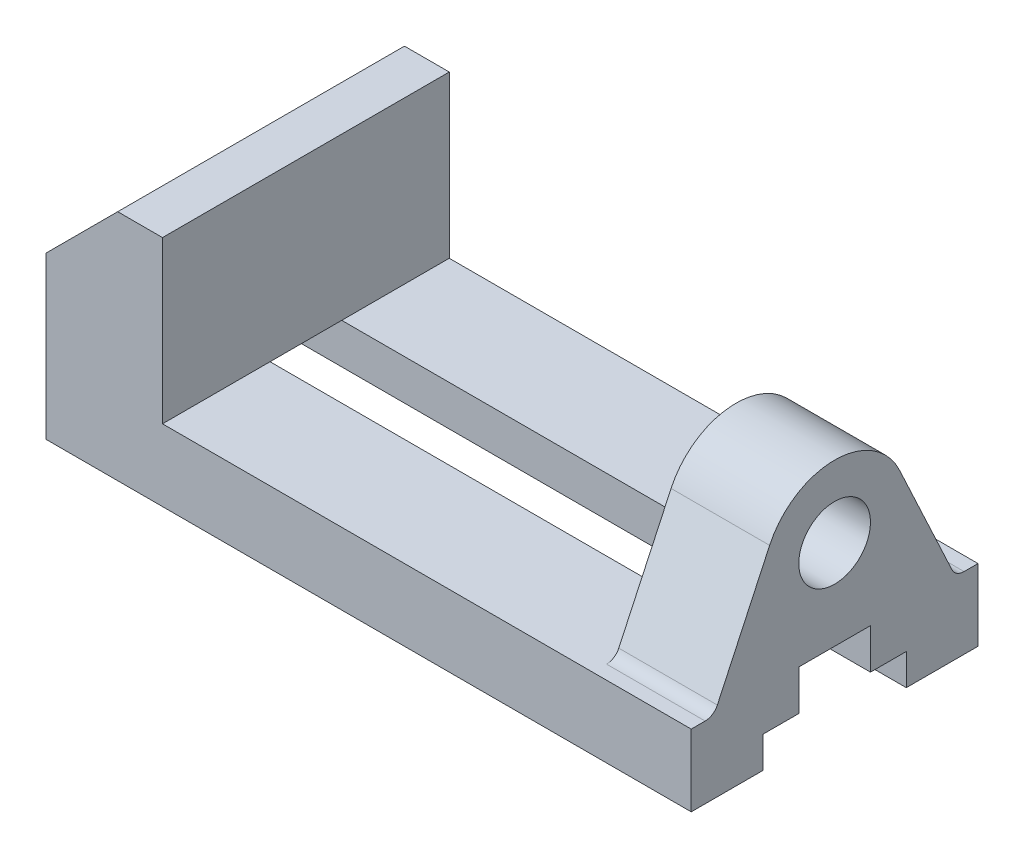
SolidWorks part; units mm, degrees
ref_plane "Front Plane" through (0, 0, 0) normal (0, 0, 1) x (1, 0, 0)
ref_plane "Top Plane" through (0, 0, 0) normal (0, 1, 0) x (1, 0, 0)
ref_plane "Right Plane" through (0, 0, 0) normal (1, 0, 0) x (0, 0, -1)
sketch "Sketch1" plane through (0, 0, 0) normal (0, 0, 1) x (1, 0, 0)
  line L0 (144, 0) -> (0, 0)
  line L1 (0, 0) -> (0, 36)
  line L2 (0, 36) -> (16, 52)
  line L3 (16, 52) -> (26, 52)
  line L4 (26, 52) -> (26, 16)
  line L5 (26, 16) -> (144, 16)
  line L6 (144, 16) -> (144, 0)
  dimension "D1" = 144
  dimension "D2" = 16
  dimension "D3" = 36
  dimension "D4" = 16
  dimension "D5" = 10
  dimension "D6" = 16
extrude "Base" add sketch "Sketch1" along normal mid plane 64
sketch "Sketch2" plane through (144, 0, 0) normal (1, 0, 0) x (0, 0, -1)
  line L0 (-14.5009, 42.7619) -> (-26.9802, 16)
  line L1 (-32, 16) -> (32, 16) construction
  line L2 (26.9802, 16) -> (14.5009, 42.7619)
  line L3 (-32, 16) -> (32, 16) construction
  line L4 (-26.9802, 16) -> (26.9802, 16)
  line L5 (-32, 52) -> (32, 52) construction
  line L6 (0, 36) -> (0, 16) construction
  arc A0 (-14.5009, 42.7619) -> (14.5009, 42.7619) centre (0, 36) cw
  dimension "D1" = 16
  dimension "D2" = 50
extrude "Left end" add sketch "Sketch2" against normal blind 22
sketch "Sketch3" plane through (144, 0, 0) normal (1, 0, 0) x (0, 0, -1)
  line L0 (-16, 0) -> (-16, 7)
  line L1 (-32, 0) -> (32, 0) construction
  line L2 (-16, 7) -> (-8, 7)
  line L3 (-8, 7) -> (-8, 16)
  line L4 (-32, 16) -> (32, 16) construction
  line L5 (-8, 16) -> (8, 16)
  line L6 (8, 16) -> (8, 7)
  line L7 (8, 7) -> (16, 7)
  line L8 (16, 7) -> (16, 0)
  line L9 (16, 0) -> (-16, 0)
  point P4 (0, 0)
  point P13 (0, 16)
  dimension "D1" = 32
  dimension "D2" = 16
  dimension "D3" = 7
  dimension "D4" = 16
extrude "Cut Extrude" cut sketch "Sketch3" against normal through all
other "Dia 16 Hole"
sketch "Sketch4" plane through (144, 0, 0) normal (1, 0, 0) x (0, 0, -1)
  circle A0 centre (0, 36) radius 8
  arc A1 (14.5009, 42.7619) -> (-14.5009, 42.7619) centre (0, 36) ccw construction
  dimension "D1" = 16
hole_wizard "Ø6.0 (6) Diameter Hole1" positions "3DSketch1" profile "Sketch5" hole size "Ø6.0" standard "Ansi Metric"
sketch3d "3DSketch1"
  line L0 (144, 0, 32) -> (144, 0, 16) construction
  line L1 (0, 0, 32) -> (144, 0, 32) construction
  point P0 (106, 0, 22)
  dimension "D1" = 38
  dimension "D2" = 10
sketch "Sketch5" plane through (106, 0, 22) normal (1, 0, 0) x (0, 0, -1)
  line L0 (0, 0) -> (0, 11.7321)
  line L1 (0, 11.7321) -> (3, 10)
  line L2 (3, 10) -> (3, 0)
  line L5 (3, 0) -> (0, 0)
  line L10 (0, 11.7321) -> (-3, 10) construction
  line L11 (0, -6.35) -> (0, 107.95) construction
  dimension "Hole Dia." = 6
  dimension "Hole Depth" = 10
  dimension "Drill Angle" = 120
pattern_linear "LPattern1" count 2 spacing 70 along (-1, 0, 0) count 2 spacing 44 along (0, 0, -1) of "Ø6.0 (6) Diameter Hole1"
fillet "Fillet1" radius 3 2 edges at (133, 16, -26.9802) (133, 16, 26.9802)
